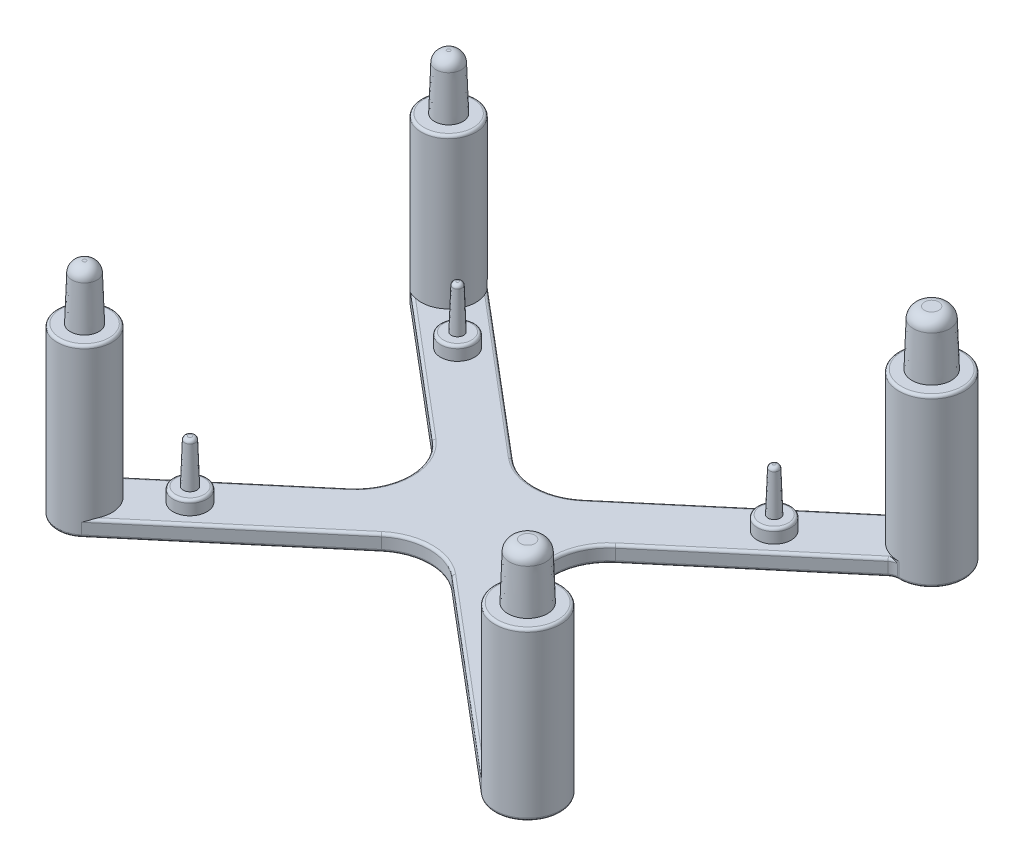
SolidWorks part; units mm, degrees
ref_plane "Front Plane" through (0, 0, 0) normal (0, 0, 1) x (1, 0, 0)
ref_plane "Top Plane" through (0, 0, 0) normal (0, 1, 0) x (1, 0, 0)
ref_plane "Right Plane" through (0, 0, 0) normal (1, 0, 0) x (0, 0, -1)
sketch "Sketch1" plane through (0, 0, 0) normal (0, 1, 0) x (1, 0, 0)
  line L0 (115.1609, 0) -> (-115.1609, 0) construction
  line L1 (-39.5, 28) -> (39.5, 28) construction
  line L2 (-42.5, 25) -> (-42.5, -25) construction
  line L3 (-39.5, -28) -> (39.5, -28) construction
  line L4 (42.5, 25) -> (42.5, -25) construction
  line L5 (-42.5, 28) -> (42.5, -28) construction
  line L6 (-42.5, -28) -> (42.5, 28) construction
  line L7 (0, -1000) -> (0, 49000) construction
  line L8 (-39, 28) -> (-39, -28) construction
  line L9 (19, 28) -> (19, -28) construction
  line L10 (-10, 28) -> (-10, -28) construction
  line L11 (-42.5, 28) -> (-42.5, -28) construction
  line L12 (-39, 24.5) -> (800.2131, -684.4906) construction
  line L13 (-39, -24.5) -> (38155.2767, 32243.0878) construction
  line L14 (-52.6951, 29.5245) -> (-26.7896, 7.6389)
  line L15 (-44.7903, 5.5) -> (-29.7903, 5.5) construction
  line L16 (-44.7903, 5.5) -> (-44.7903, -5.5) construction
  line L17 (-44.7903, -5.5) -> (-29.7903, -5.5) construction
  line L18 (-29.7903, 5.5) -> (-29.7903, -5.5) construction
  line L19 (-44.7903, 5.5) -> (-29.7903, -5.5) construction
  line L20 (-44.7903, -5.5) -> (-29.7903, 5.5) construction
  line L21 (-3.5465, -11.9976) -> (31.4733, -41.5833)
  line L22 (-35.4, -21.96) -> (15.4, -21.96) construction
  line L23 (-35.4, -21.96) -> (-35.4, -27.04) construction
  line L24 (-35.4, -27.04) -> (15.4, -27.04) construction
  line L25 (15.4, -21.96) -> (15.4, -27.04) construction
  line L26 (-35.4, -21.96) -> (15.4, -27.04) construction
  line L27 (-35.4, -27.04) -> (15.4, -21.96) construction
  line L28 (-52.6951, -29.5245) -> (-26.7896, -7.6389)
  line L29 (-46.2415, 37.1634) -> (-16.4535, 11.9976)
  line L30 (6.7896, -7.6389) -> (33.8594, -30.5082)
  line L31 (6.7896, 7.6389) -> (33.8594, 30.5082)
  line L32 (-46.2415, -37.1634) -> (-16.4535, -11.9976)
  line L33 (-3.5465, 11.9976) -> (31.4733, 41.5833)
  line L34 (-10.2298, 6.7397) -> (-10, 6.5455)
  line L35 (-38.3546, -25.2639) -> (38155.9221, 32242.3239) construction
  line L36 (-36.4186, -27.5555) -> (38157.8581, 32240.0323) construction
  line L37 (35.3454, 31) -> (35.0842, 31)
  line L38 (-10, 6.5455) -> (-9.9716, 6.5695)
  line L42 (35.3454, -31) -> (35.0842, -31)
  circle A0 centre (19, 24.5) radius 1.375 construction
  arc A1 (42.5, 25) -> (39.5, 28) centre (39.5, 25) ccw construction
  arc A2 (42.5, -25) -> (39.5, -28) centre (39.5, -25) cw construction
  circle A3 centre (19, -24.5) radius 1.375 construction
  arc A4 (-42.5, 25) -> (-39.5, 28) centre (-39.5, 25) cw construction
  arc A5 (-42.5, -25) -> (-39.5, -28) centre (-39.5, -25) ccw construction
  circle A6 centre (-39, -24.5) radius 1.375 construction
  circle A7 centre (-39, 24.5) radius 1.375 construction
  circle A8 centre (19, 24.5) radius 3.1 construction
  circle A9 centre (19, -24.5) radius 3.1 construction
  circle A10 centre (-39, -24.5) radius 3.1 construction
  circle A11 centre (-39, 24.5) radius 3.1 construction
  arc A12 (-46.2415, 37.1634) -> (-52.6951, 29.5245) centre (-49.4683, 33.3439) ccw
  circle A13 centre (-49.4683, 33.3439) radius 5 construction
  circle A14 centre (-49.4683, 33.3439) radius 3
  circle A15 centre (-49.4683, -33.3439) radius 5 construction
  circle A16 centre (-49.4683, -33.3439) radius 3
  arc A17 (-46.2415, -37.1634) -> (-52.6951, -29.5245) centre (-49.4683, -33.3439) cw
  arc A18 (35.3454, 31) -> (31.4733, 41.5833) centre (35.3454, 37) ccw
  circle A19 centre (35.3454, 37) radius 4
  circle A20 centre (35.3454, 37) radius 6 construction
  arc A21 (35.0842, 31) -> (33.8594, 30.5082) centre (35.2148, 28.9038) ccw
  circle A22 centre (35.3454, -37) radius 6 construction
  circle A23 centre (35.3454, -37) radius 4
  arc A24 (35.0842, -31) -> (33.8594, -30.5082) centre (35.2148, -28.9038) cw
  arc A25 (35.3454, -31) -> (31.4733, -41.5833) centre (35.3454, -37) cw
  arc A26 (6.7896, 7.6389) -> (6.7896, -7.6389) centre (13.2431, 0) ccw
  arc A27 (-26.7896, 7.6389) -> (-26.7896, -7.6389) centre (-33.2431, 0) cw
  arc A28 (-16.4535, 11.9976) -> (-3.5465, 11.9976) centre (-10, 19.6364) ccw
  arc A29 (-16.4535, -11.9976) -> (-3.5465, -11.9976) centre (-10, -19.6364) cw
  point P0 (0, 0)
  point P9 (0, 0)
  point P26 (19, 24.5)
  point P43 (-37.2903, 0)
  point P53 (-10, -24.5)
  point P54 (-10, -24.5)
  point P66 (-45.6489, 30.1172)
  point P67 (-41.8295, 26.8904)
  point P72 (-17.7477, 0)
  point P83 (41.4311, 27.2958)
  dimension "D5" = 3.5
  dimension "D6" = 3
  dimension "D8" = 2.75
  dimension "D10" = 6.2
  dimension "D20" = 10
  dimension "D22" = 1
  dimension "D25" = 6
  dimension "D26" = 8
  dimension "D27" = 12
  dimension "D1" = 56
  dimension "D2" = 85
  dimension "D7" = 3
  dimension "D11" = 15
  dimension "D12" = 11
  dimension "D14" = 3.5
  dimension "D15" = 3.5
  dimension "D16" = 5.08
  dimension "D17" = 50.8
  dimension "D21" = 5
  dimension "D23" = 9
  dimension "D3" = 3.5
  dimension "D4" = 58
  dimension "D9" = 29
  dimension "D24" = 4
extrude "Boss-Extrude1" add sketch "Sketch1" against normal blind 3
sketch "Sketch2" plane through (0, 0, 0) normal (0, 1, 0) x (1, 0, 0)
  line L0 (-1000, 0) -> (49000, 0) construction
  circle A0 centre (-49.4683, 33.3439) radius 5
  circle A1 centre (-49.4683, -33.3439) radius 5
  circle A2 centre (35.3454, 37) radius 6
  circle A3 centre (35.3454, -37) radius 6
  circle A4 centre (35.3454, 37) radius 4
  circle A5 centre (35.3454, -37) radius 4
  circle A6 centre (-49.4683, -33.3439) radius 3
  circle A7 centre (-49.4683, 33.3439) radius 3
  circle A8 centre (-39, 24.5) radius 1.375 construction
  circle A9 centre (-39, 24.5) radius 3.1
  circle A10 centre (-39, -24.5) radius 1.375 construction
  circle A11 centre (-39, -24.5) radius 3.1
  circle A12 centre (19, 24.5) radius 1.375 construction
  circle A13 centre (19, 24.5) radius 3.1
  circle A14 centre (19, -24.5) radius 1.375 construction
  circle A15 centre (19, -24.5) radius 3.1
extrude "Boss-Extrude2" add sketch "Sketch2" along normal blind 2.5
sketch "Sketch4" plane through (0, 2.5, 0) normal (0, 1, 0) x (1, 0, 0)
  circle A0 centre (35.3454, -37) radius 6
  circle A1 centre (35.3454, -37) radius 4
  circle A2 centre (35.3454, 37) radius 6
  circle A3 centre (35.3454, 37) radius 4
  circle A4 centre (19, 24.5) radius 1.375 construction
  circle A5 centre (19, 24.5) radius 3.1 construction
  circle A6 centre (19, 24.5) radius 1.125
  circle A7 centre (19, -24.5) radius 1.375 construction
  circle A8 centre (19, -24.5) radius 3.1 construction
  circle A9 centre (19, -24.5) radius 1.25
  circle A10 centre (-39, -24.5) radius 1.375 construction
  circle A11 centre (-39, -24.5) radius 3.1 construction
  circle A12 centre (-39, -24.5) radius 1.25
  circle A13 centre (-39, 24.5) radius 1.375 construction
  circle A14 centre (-39, 24.5) radius 3.1 construction
  circle A15 centre (-39, 24.5) radius 1.125
  circle A16 centre (-49.4683, 33.3439) radius 3
  circle A17 centre (-49.4683, 33.3439) radius 5
  circle A18 centre (-49.4683, -33.3439) radius 3
  circle A19 centre (-49.4683, -33.3439) radius 5
extrude "Boss-Extrude3" add sketch "Sketch4" along normal blind 8
sketch "Sketch5" plane through (0, 10.5, 0) normal (0, 1, 0) x (1, 0, 0)
  circle A0 centre (-49.4683, 33.3439) radius 3
  circle A1 centre (-49.4683, 33.3439) radius 5
  circle A2 centre (-49.4683, -33.3439) radius 3
  circle A3 centre (-49.4683, -33.3439) radius 5
  circle A4 centre (35.3454, -37) radius 4
  circle A5 centre (35.3454, -37) radius 6
  circle A6 centre (35.3454, 37) radius 4
  circle A7 centre (35.3454, 37) radius 6
extrude "Boss-Extrude4" add sketch "Sketch5" along normal blind 12
sketch "Sketch7" plane through (0, 22.5, 0) normal (0, 1, 0) x (1, 0, 0)
  circle A0 centre (35.3454, 37) radius 6
  circle A1 centre (-49.4683, 33.3439) radius 5
  circle A3 centre (-49.4683, -33.3439) radius 5
  circle A4 centre (35.3454, -37) radius 6
extrude "Boss-Extrude5" add sketch "Sketch7" along normal blind 5
sketch "Sketch8" plane through (0, 27.5, 0) normal (0, 1, 0) x (1, 0, 0)
  circle A0 centre (-49.4683, 33.3439) radius 3 construction
  circle A1 centre (-49.4683, 33.3439) radius 2.6
  circle A2 centre (-49.4683, -33.3439) radius 2.6
  circle A3 centre (35.3454, 37) radius 4 construction
  circle A4 centre (35.3454, 37) radius 3.6
  circle A5 centre (35.3454, -37) radius 3.6
  dimension "D1" = 6
extrude "Boss-Extrude6" add sketch "Sketch8" along normal blind 10
draft "Draft9" type of draft neutral plane draft angle 2 faces to draft 4 parameters "D1"=2
fillet "Fillet1" radius 2 4 edges at (-49.4683, 37.5, -31.0931) (-49.4683, 37.5, 35.5947) (35.3454, 37.5, 40.2508) (35.3454, 37.5, -33.7492)
fillet "Fillet2" radius 0.5 4 edges at (35.3454, 27.5, 43) (35.3454, 27.5, -31) (-49.4683, 27.5, -28.3439) (-49.4683, 27.5, 38.3439)
fillet "Fillet3" radius 0.5 4 edges at (19, 2.5, -21.4) (19, 2.5, 27.6) (-39, 2.5, -21.4) (-39, 2.5, 21.4)
fillet "Fillet8" radius 0.5 24 edges at (-10, -3, 9.6364) (13.9634, -3, 26.7905) (40.9802, -3, 39.0616) (35.2148, -3, 31) (34.4322, -3, 30.8528) (20.3245, -3, 19.0735) (3.2431, -3, 0) (20.3245, -3, -19.0735) (34.4322, -3, -30.8528) (35.2148, -3, -31) (40.9802, -3, -39.0616) (13.9634, -3, -26.7905) (-10, -3, -9.6364) (-31.3475, -3, -24.5805) (-53.2877, -3, -36.5707) (-39.7423, -3, -18.5817) (-23.2431, -3, 0) (-39.7423, -3, 18.5817) (-53.2877, -3, 36.5707) (-31.3475, -3, 24.5805) (-49.4683, -3, 36.3439) (-49.4683, -3, -30.3439) (35.3454, -3, -33) (35.3454, -3, 41)
fillet "Fillet10" radius 0.5 14 edges at (-39.7423, 0, -18.5817) (-39.7423, 0, 18.5817) (-31.3475, 0, -24.5805) (13.9634, 0, -26.7905) (34.4322, 0, -30.8528) (20.3245, 0, -19.0735) (34.4322, 0, 30.8528) (20.3245, 0, 19.0735) (-31.3475, 0, 24.5805) (13.9634, 0, 26.7905) (-23.2431, 0, 0) (-10, 0, -9.6364) (3.2431, 0, 0) (-10, 0, 9.6364)
draft "Draft6" type of draft neutral plane draft angle 2 faces to draft 4 parameters "D1"=2
fillet "Fillet11" radius 0.635 4 edges at (19, 10.5, 25.4706) (19, 10.5, -23.6544) (-39, 10.5, -23.6544) (-39, 10.5, 25.4706)
